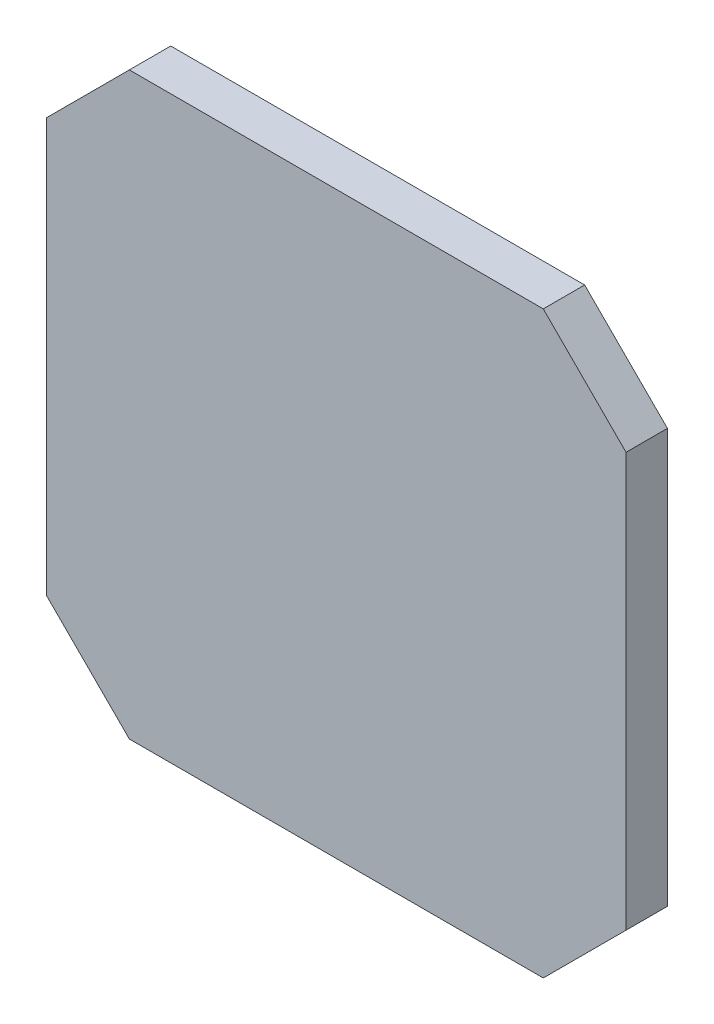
SolidWorks part; units mm, degrees
ref_plane "Face" through (0, 0, 0) normal (0, 0, 1) x (1, 0, 0)
ref_plane "Dessus" through (0, 0, 0) normal (0, 1, 0) x (1, 0, 0)
ref_plane "Droite" through (0, 0, 0) normal (1, 0, 0) x (0, 0, -1)
sketch "Esquisse1" plane through (0, 0, 0) normal (0, 0, 1) x (1, 0, 0)
  line L0 (60, 0) -> (70, -10)
  line L1 (10, 0) -> (60, 0)
  line L2 (0, -10) -> (0, -60)
  line L3 (10, -70) -> (60, -70)
  line L4 (70, -10) -> (70, -60)
  line L5 (0, -10) -> (10, 0)
  line L6 (0, -60) -> (10, -70)
  line L7 (60, -70) -> (70, -60)
  point P0 (70, -70)
  point P1 (0, -70)
  point P2 (70, 0)
  point P4 (0, 0)
  dimension "D1" = 70
  dimension "D4" = 10
  dimension "D5" = 10
  dimension "D6" = 10
  dimension "D7" = 10
extrude "Base-Extrusion" add sketch "Esquisse1" along normal blind 5
